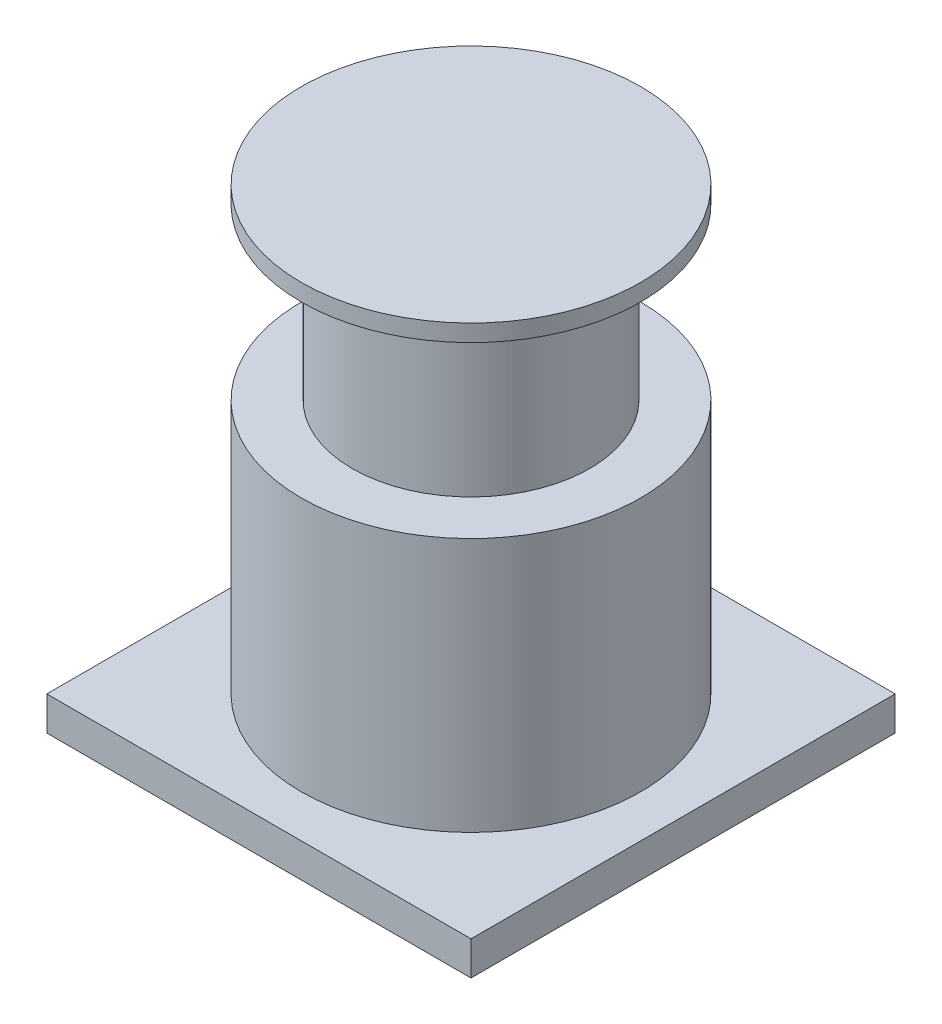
SolidWorks part; units mm, degrees
ref_plane "Front Plane" through (0, 0, 0) normal (0, 0, 1) x (1, 0, 0)
ref_plane "Top Plane" through (0, 0, 0) normal (0, 1, 0) x (1, 0, 0)
ref_plane "Right Plane" through (0, 0, 0) normal (1, 0, 0) x (0, 0, -1)
sketch "Sketch1" plane through (0, 0, 0) normal (0, 1, 0) x (1, 0, 0)
  line L1 (-78.1893, -163.1687) -> (171.8107, -163.1687)
  line L2 (-78.1893, -163.1687) -> (-78.1893, 86.8313)
  line L3 (-78.1893, 86.8313) -> (171.8107, 86.8313)
  line L4 (171.8107, -163.1687) -> (171.8107, 86.8313)
  dimension "D1" = 250
  dimension "D2" = 250
extrude "Boss-Extrude1" add sketch "Sketch1" along normal blind 20
sketch "Sketch2" plane through (0, 20, 0) normal (0, 1, 0) x (1, 0, 0)
  line L0 (171.8107, 86.8313) -> (-78.1893, 86.8313) construction
  line L1 (171.8107, -163.1687) -> (171.8107, 86.8313) construction
  circle A0 centre (46.8107, -38.1687) radius 100
  point P4 (46.8107, 86.8313)
  point P7 (171.8107, -38.1687)
  dimension "D1" = 200
extrude "Boss-Extrude2" add sketch "Sketch2" along normal blind 150
sketch "Sketch3" plane through (0, 170, 0) normal (0, 1, 0) x (1, 0, 0)
  circle A0 centre (46.8107, -38.1687) radius 70
  dimension "D1" = 140
extrude "Boss-Extrude3" add sketch "Sketch3" along normal blind 100
sketch "Sketch4" plane through (0, 270, 0) normal (0, 1, 0) x (1, 0, 0)
  circle A0 centre (46.8107, -38.1687) radius 100
extrude "Boss-Extrude4" add sketch "Sketch4" along normal blind 10
